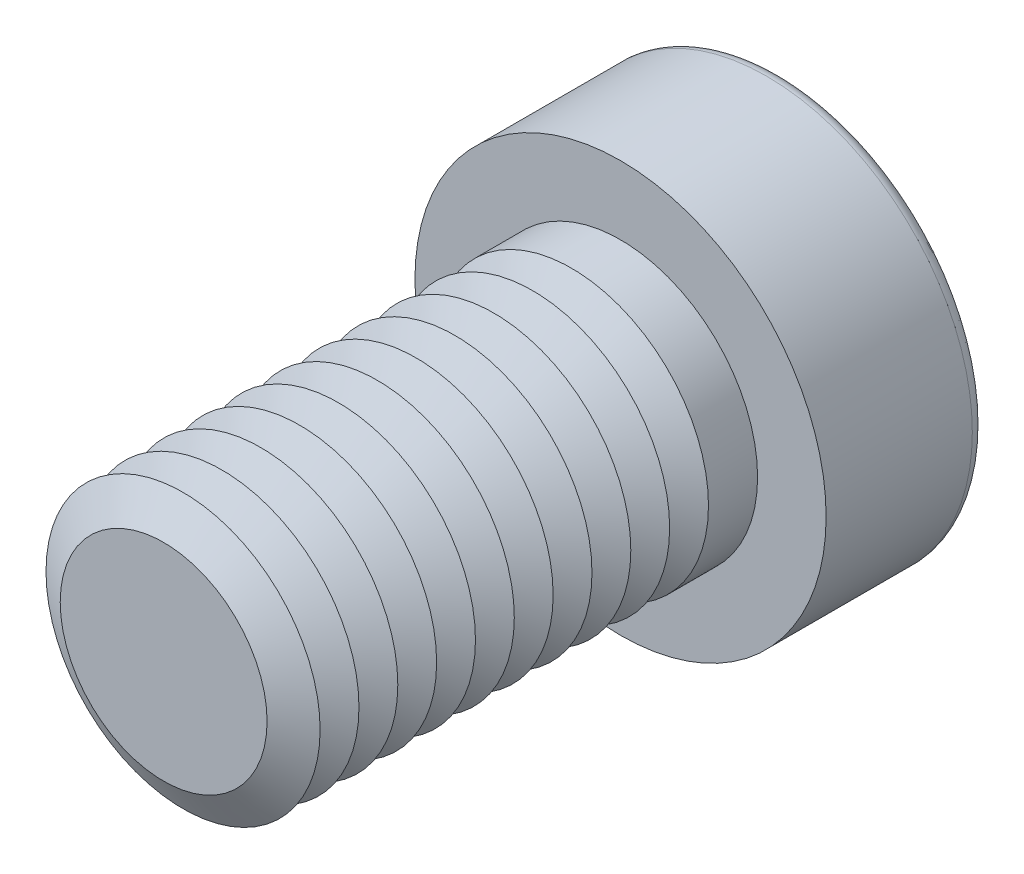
SolidWorks part; units mm, degrees
ref_plane "Front Plane" through (0, 0, 0) normal (0, 0, 1) x (1, 0, 0)
ref_plane "Top Plane" through (0, 0, 0) normal (0, 1, 0) x (1, 0, 0)
ref_plane "Right Plane" through (0, 0, 0) normal (1, 0, 0) x (0, 0, -1)
sketch "Sketch1" plane through (0, 0, 0) normal (0, 0, 1) x (1, 0, 0)
  circle A0 centre (0, 0) radius 6
  dimension "D1" = 12
extrude "Boss-Extrude1" add sketch "Sketch1" along normal blind 20
sketch "Sketch2" plane through (0, 0, 0) normal (0, 0, -1) x (-1, 0, 0)
  circle A0 centre (0, 0) radius 9
  dimension "D1" = 18
extrude "Boss-Extrude2" add sketch "Sketch2" along normal blind 7
sketch "Sketch3" plane through (0, 0, -7) normal (0, 0, -1) x (-1, 0, 0)
  line L1 (-2.3094, 4) -> (-4.6188, 0)
  line L2 (-4.6188, 0) -> (-2.3094, -4)
  line L3 (-2.3094, -4) -> (2.3094, -4)
  line L4 (2.3094, -4) -> (4.6188, 0)
  line L5 (4.6188, 0) -> (2.3094, 4)
  line L6 (2.3094, 4) -> (-2.3094, 4)
  circle A0 centre (0, 0) radius 4 construction
  dimension "D1" = 8
extrude "Cut-Extrude1" cut sketch "Sketch3" against normal blind 6
fillet "Fillet1" radius 0.6 1 edges at (-9, 0, -7)
sketch "Sketch4" plane through (0, 0, -1) normal (0, 0, -1) x (-1, 0, 0)
  line L0 (2.3094, -4) -> (4.6188, 0) construction
  circle A0 centre (0, 0) radius 4
extrude "Cut-Extrude2" cut sketch "Sketch4" against normal through all draft 60
sketch "Sketch5" plane through (0, 0, -7) normal (0, 0, -1) x (-1, 0, 0)
  circle A0 centre (0, 0) radius 4.6188
extrude "Cut-Extrude3" cut sketch "Sketch5" against normal through all draft 75
sketch "Sketch7" plane through (0, 0, 0) normal (1, 0, 0) x (0, 0, -1)
  line L25 (-20, 4.5278) -> (-19.15, 6)
  line L26 (-20, 6) -> (-20, -6) construction
  line L27 (-19.15, 6) -> (-20.85, 6)
  line L28 (-20.85, 6) -> (-20, 4.5278)
  line L29 (0, 6) -> (-20, 6) construction
  dimension "D1" = 1.7
revolve "Cut-Revolve1" cut sketch "Sketch7" angle 360 about axis through (0, 0, 20) along (0, 0, -1)
pattern_linear "LPattern1" count 11 spacing 1.7 along (0, 0, -1) of "Cut-Revolve1"
